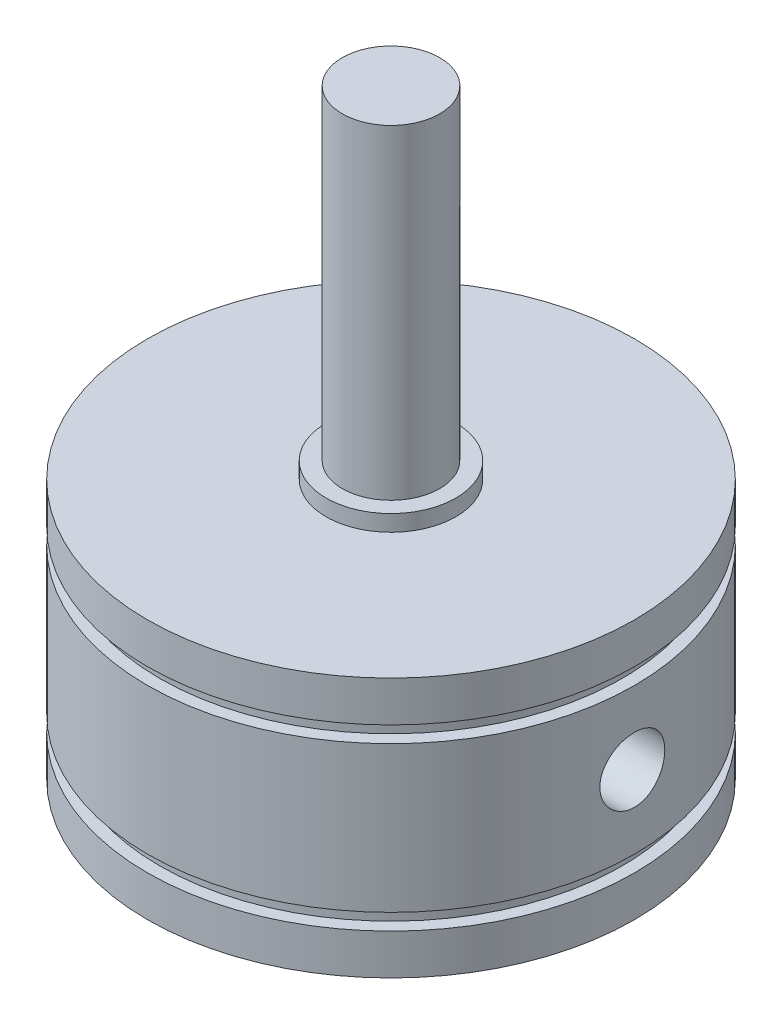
SolidWorks part; units mm, degrees
ref_plane "Plano frontal" through (0, 0, 0) normal (0, 0, 1) x (1, 0, 0)
ref_plane "Plano superior" through (0, 0, 0) normal (0, 1, 0) x (1, 0, 0)
ref_plane "Plano direito" through (0, 0, 0) normal (1, 0, 0) x (0, 0, -1)
sketch "Esboço1" plane through (0, 0, 0) normal (0, 0, 1) x (1, 0, 0)
  line L0 (0, 0) -> (0, 74.4448) construction
  line L1 (0, 0) -> (37.3667, 0) construction
  line L2 (0, 29) -> (3, 29)
  line L3 (3, 29) -> (3, 9)
  line L4 (3, 9) -> (4, 9)
  line L5 (4, 9) -> (4, 8)
  line L6 (4, 8) -> (15, 8)
  line L7 (15, 8) -> (15, 5.5)
  line L8 (15, 5.5) -> (14.25, 5.5)
  line L9 (14.25, 5.5) -> (14.25, 4.5)
  line L10 (14.25, 4.5) -> (15, 4.5)
  line L11 (15, 4.5) -> (15, -4.5)
  line L12 (0, 29) -> (0, 0)
  line L13 (14.25, -4.5) -> (15, -4.5)
  line L14 (14.25, -5.5) -> (14.25, -4.5)
  line L15 (15, -5.5) -> (14.25, -5.5)
  line L16 (15, -8) -> (15, -5.5)
  line L17 (4, -8) -> (15, -8)
  line L18 (4, -9) -> (4, -8)
  line L19 (3, -9) -> (4, -9)
  line L20 (3, -9) -> (3, -12)
  line L21 (3, -12) -> (0, -12)
  line L22 (0, -12) -> (0, 0)
  point P16 (15, 0)
  dimension "D1" = 16
  dimension "D2" = 1
  dimension "D3" = 0.75
  dimension "D4" = 2.5
  dimension "D5" = 30
  dimension "D6" = 1
  dimension "D7" = 8
  dimension "D8" = 6
  dimension "D9" = 3
  dimension "D10" = 20
revolve "Revolução1" add sketch "Esboço1" angle 360 about L0
ref_plane "Plano1" through (-15, 0, 0) normal (-1, 0, 0) x (0, 0, 1)
ref_plane "Plano2" through (15, 0, 0) normal (1, 0, 0) x (0, 0, -1)
ref_plane "Plano3" through (-14.4889, 0, 3.8823) normal (-0.9659, 0, 0.2588) x (0, -1, 0)
ref_plane "Plano4" through (-14.4889, 0, -3.8823) normal (-0.9659, 0, -0.2588) x (0, -1, 0)
hole_wizard "Furos-guia com Ø4.0mm1" positions "3DSketch3" profile "Esboço10" hole size "Ø4.0" standard "Ansi Metric"
sketch3d "3DSketch3"
  point P0 (15, 0, 0)
sketch "Esboço10" plane through (15, 0, 0) normal (0, 1, 0) x (0, 0, -1)
  line L0 (0, 0) -> (0, 16.2017)
  line L1 (0, 16.2017) -> (2, 15)
  line L2 (2, 15) -> (2, 0)
  line L5 (2, 0) -> (0, 0)
  line L10 (0, 16.2017) -> (-2, 15) construction
  line L11 (0, -6.35) -> (0, 107.95) construction
  dimension "Hole Dia." = 4
  dimension "Hole Depth" = 15
  dimension "Drill Angle" = 118
sketch "Esboço14" plane through (-14.4889, 0, -3.8823) normal (-0.9659, 0, -0.2588) x (0, -1, 0)
  circle A0 centre (0, 0) radius 3
  dimension "D1" = 6
sketch "Esboço15" plane through (-14.4889, 0, 3.8823) normal (-0.9659, 0, 0.2588) x (0, -1, 0)
  circle A0 centre (0, 0) radius 3
  dimension "D1" = 6
sketch "Esboço16" plane through (0, 0, 0) normal (0, 1, 0) x (1, 0, 0)
  line L0 (0, 0) -> (-14.4889, -3.8823)
  line L1 (0, 0) -> (-14.4889, 3.8823)
hole_wizard "Furos-guia com Ø6.0mm3" positions "3DSketch7" profile "Esboço17" hole size "Ø6.0" standard "Ansi Metric"
sketch3d "3DSketch7"
  point P0 (-14.4889, 0, -3.8823)
sketch "Esboço17" plane through (-14.4889, 0, -3.8823) normal (0, 1, 0) x (-0.2588, 0, 0.9659)
  line L0 (0, 0) -> (0, 16.8026)
  line L1 (0, 16.8026) -> (3, 15)
  line L2 (3, 15) -> (3, 0)
  line L5 (3, 0) -> (0, 0)
  line L10 (0, 16.8026) -> (-3, 15) construction
  line L11 (0, -6.35) -> (0, 107.95) construction
  dimension "Hole Dia." = 6
  dimension "Hole Depth" = 15
  dimension "Drill Angle" = 118
hole_wizard "Furos-guia com Ø6.0mm4" positions "3DSketch8" profile "Esboço18" hole size "Ø6.0" standard "Ansi Metric"
sketch3d "3DSketch8"
  point P0 (-14.4889, 0, 3.8823)
sketch "Esboço18" plane through (-14.4889, 0, 3.8823) normal (0, 1, 0) x (0.2588, 0, 0.9659)
  line L0 (0, 0) -> (0, 16.8026)
  line L1 (0, 16.8026) -> (3, 15)
  line L2 (3, 15) -> (3, 0)
  line L5 (3, 0) -> (0, 0)
  line L10 (0, 16.8026) -> (-3, 15) construction
  line L11 (0, -6.35) -> (0, 107.95) construction
  dimension "Hole Dia." = 6
  dimension "Hole Depth" = 15
  dimension "Drill Angle" = 118
